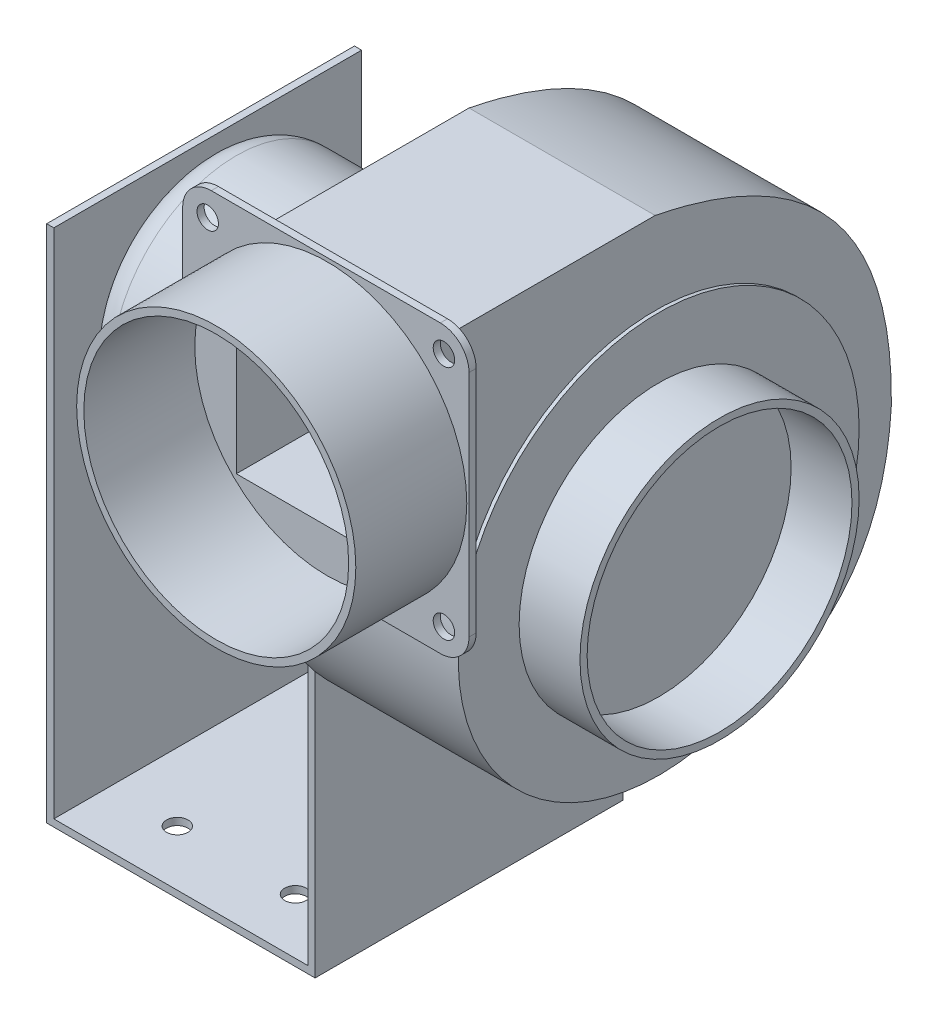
SolidWorks part; units mm, degrees
ref_plane "前视基准面" through (0, 0, 0) normal (0, 0, 1) x (1, 0, 0)
ref_plane "上视基准面" through (0, 0, 0) normal (0, 1, 0) x (1, 0, 0)
ref_plane "右视基准面" through (0, 0, 0) normal (1, 0, 0) x (0, 0, -1)
sketch "草图1" plane through (0, 0, 0) normal (1, 0, 0) x (0, 0, -1)
  line L2 (0, 79) -> (-64, 79)
  line L3 (-64, 79) -> (-64, 19)
  line L4 (-64, 19) -> (-52.6783, 19)
  arc A0 (-52.6783, 19) -> (0, -56) centre (0, 0) ccw
  spline S0 degree 2 poles (0, -56) (62.6147, -57.8374) (66, 0) knots 0 0 0 1 1 1
  spline S1 degree 2 poles (0, 79) (66.9276, 65.8024) (66, 0) knots 0 0 0 1 1 1
extrude "凸台-拉伸1" add sketch "草图1" along normal blind 52
sketch "草图2" plane through (0, 0, 64) normal (0, 0, 1) x (1, 0, 0)
  line L2 (-6, 9) -> (58, 9)
  line L3 (-14, 17) -> (-14, 81)
  line L4 (-6, 89) -> (58, 89)
  line L5 (66, 17) -> (66, 81)
  line L6 (-14, 9) -> (66, 89) construction
  line L7 (-14, 89) -> (66, 9) construction
  arc A0 (-6, 9) -> (-14, 17) centre (-6, 17) cw
  arc A1 (58, 9) -> (66, 17) centre (58, 17) ccw
  arc A2 (58, 89) -> (66, 81) centre (58, 81) cw
  arc A3 (-14, 81) -> (-6, 89) centre (-6, 81) cw
  point P4 (26, 49)
  dimension "D1" = 8
extrude "凸台-拉伸2" add sketch "草图2" along normal blind 2
sketch "草图3" plane through (0, 0, 66) normal (0, 0, 1) x (1, 0, 0)
  circle A0 centre (-7, 82) radius 3
  circle A1 centre (59, 82) radius 3
  circle A2 centre (59, 16) radius 3
  circle A3 centre (-7, 16) radius 3
  point P6 (26, 49)
extrude "切除-拉伸1" cut sketch "草图3" against normal blind 2
sketch "草图4" plane through (52, 0, 0) normal (1, 0, 0) x (0, 0, -1)
  circle A0 centre (0, 0) radius 56
extrude "凸台-拉伸3" add sketch "草图4" along normal blind 1 separate body
sketch "草图5" plane through (53, 0, 0) normal (1, 0, 0) x (0, 0, -1)
  circle A0 centre (0, 0) radius 39
  circle A1 centre (0, 0) radius 37
extrude "凸台-拉伸4" add sketch "草图5" along normal blind 17
sketch "草图6" plane through (0, 0, 0) normal (-1, 0, 0) x (0, 0, 1)
  circle A0 centre (0, 0) radius 35
extrude "凸台-拉伸5" add sketch "草图6" along normal blind 73
fillet "圆角1" radius 8 1 edges at (-73, 0, 35)
sketch "草图7" plane through (0, 0, 66) normal (0, 0, 1) x (1, 0, 0)
  line L4 (1, 24) -> (51, 24)
  line L5 (1, 24) -> (1, 74)
  line L6 (1, 74) -> (51, 74)
  line L7 (51, 24) -> (51, 74)
  line L8 (1, 24) -> (51, 74) construction
  line L9 (1, 74) -> (51, 24) construction
  point P6 (26, 49)
extrude "切除-拉伸2" cut sketch "草图7" against normal blind 73
sketch "草图8" plane through (0, 0, 66) normal (0, 0, 1) x (1, 0, 0)
  circle A0 centre (26.382, 49) radius 39
  circle A1 centre (26.382, 49) radius 37
extrude "凸台-拉伸6" add sketch "草图8" along normal blind 31
sketch "草图9" plane through (-73, 0, 0) normal (-1, 0, 0) x (0, 0, 1)
  line L0 (-43, -110) -> (43, -110)
  line L1 (43, 35) -> (-43, 35)
  line L2 (-43, 35) -> (-43, -110)
  line L5 (43, 35) -> (43, -110)
extrude "凸台-拉伸7" add sketch "草图9" along normal blind 2 separate body
sketch "草图11" plane through (-73, 0, 0) normal (1, 0, 0) x (0, 0, -1)
  line L0 (-43, -110) -> (43, -110)
  line L1 (43, -110) -> (43, -108)
  line L2 (43, 35) -> (43, -110) construction
  line L3 (43, -108) -> (-43, -108)
  line L4 (-43, -110) -> (-43, 35) construction
  line L5 (-43, -108) -> (-43, -110)
extrude "凸台-拉伸8" add sketch "草图11" along normal blind 73
sketch "草图18" plane through (0, -110, 0) normal (0, -1, 0) x (1, 0, 0)
  circle A0 centre (-54, 27.5) radius 3
  circle A1 centre (-21, 27.5) radius 3
  circle A2 centre (-21, -27.5) radius 3
  circle A3 centre (-54, -27.5) radius 3
extrude "切除-拉伸3" cut sketch "草图18" against normal blind 2
sketch "草图22" plane through (0, -108, 0) normal (0, 1, 0) x (1, 0, 0)
  line L0 (0, 43) -> (0, -43)
  line L1 (0, -43) -> (-2, -43)
  line L2 (0, -43) -> (-73, -43) construction
  line L3 (-2, -43) -> (-2, 43)
  line L4 (0, 43) -> (-73, 43) construction
  line L5 (-2, 43) -> (0, 43)
extrude "凸台-拉伸9" add sketch "草图22" along normal blind 143
